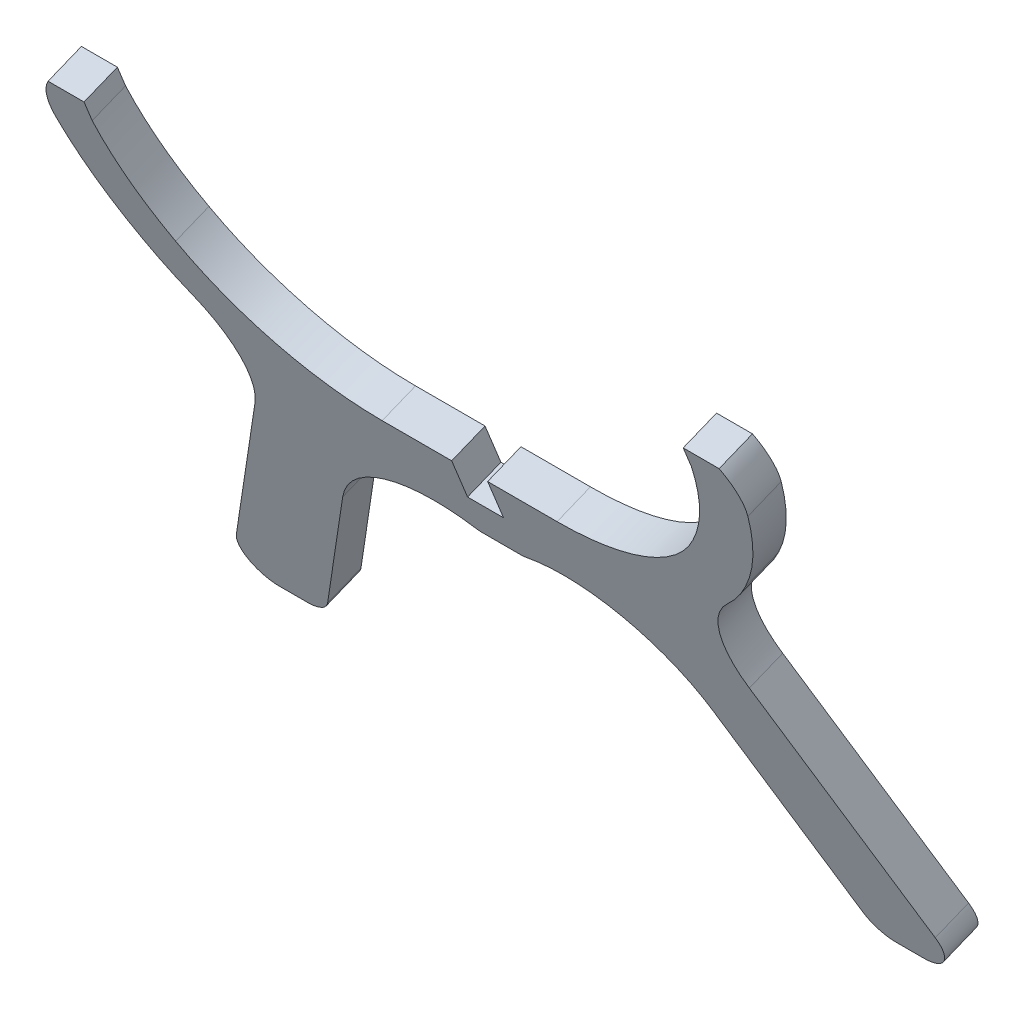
SolidWorks part; units mm, degrees
ref_plane "Спереди" through (0, 0, 0) normal (0, 0, 1) x (1, 0, 0)
ref_plane "Сверху" through (0, 0, 0) normal (0, 1, 0) x (1, 0, 0)
ref_plane "Справа" through (0, 0, 0) normal (1, 0, 0) x (0, 0, -1)
ref_plane "Плоскость4" through (0, 0, 0) normal (0, 0.3746, -0.9272) x (-1, 0, 0)
sketch "Эскиз1" plane through (0, 0, 0) normal (0, 0.3746, -0.9272) x (-1, 0, 0)
  line L0 (0, -535) -> (0, -802.9537) construction
  line L1 (-336, -220) -> (-300, -220) construction
  line L2 (300, -220) -> (719.5377, -220) construction
  line L3 (-452.8254, -802.9537) -> (523.246, -802.9537) construction
  line L4 (0, -535) -> (0, -45) construction
  line L5 (0, -510.8025) -> (0, -872.7774) construction
  line L6 (-300, -241.8808) -> (-300, -220)
  line L7 (-300, -220) -> (-336, -220)
  line L8 (-19.3609, -535) -> (19.3609, -535)
  line L9 (336, -220) -> (300, -220)
  line L10 (300, -220) -> (300, -241.8808)
  line L11 (87.5793, -450) -> (-87.5793, -450)
  line L12 (-300, -241.8808) -> (-300, -220)
  line L13 (-300, -220) -> (-336, -220)
  line L14 (-19.3609, -535) -> (19.3609, -535)
  line L15 (336, -220) -> (300, -220)
  line L16 (300, -220) -> (300, -241.8808)
  line L17 (87.5793, -450) -> (18, -450)
  line L19 (-155.527, -438.281) -> (-322.6744, -802.9537) construction
  line L20 (-247.5133, -536.9714) -> (-349.9462, -760.4537)
  line L21 (-185.4706, -605.6103) -> (-267.9017, -785.4537)
  line L22 (-193.8826, -419.963) -> (-361.3095, -785.2453) construction
  line L23 (-322.6744, -802.9537) -> (-295.1735, -802.9537)
  line L24 (-155.2475, -437.6713) -> (-322.6744, -802.9537) construction
  line L25 (247.5133, -536.9714) -> (349.9462, -760.4537)
  line L26 (-346.4425, -268.8974) -> (-346.4425, -845.878) construction
  line L27 (322.6744, -802.9537) -> (295.1735, -802.9537)
  line L28 (185.4706, -605.6103) -> (267.9017, -785.4537)
  line L29 (-116.6125, -455.3796) -> (-284.0394, -820.662) construction
  line L30 (-18, -450) -> (-18, -492.5)
  line L31 (-18, -492.5) -> (18, -492.5)
  line L32 (18, -450) -> (18, -492.5)
  line L33 (-18, -450) -> (-87.5793, -450)
  arc A0 (-267.9017, -785.4537) -> (-295.1735, -802.9537) centre (-295.1735, -772.9537) cw
  arc A1 (-349.9462, -760.4537) -> (-322.6744, -802.9537) centre (-322.6744, -772.9537) ccw
  arc A2 (-247.5133, -536.9714) -> (-267.3279, -424.9767) centre (-338.4192, -495.3047) ccw
  arc A5 (-25.2946, -534.0995) -> (-185.4706, -605.6103) centre (-64.7078, -660.9618) ccw
  arc A6 (301.1642, -382.4746) -> (267.3279, -424.9767) centre (87.5793, -247.158) cw
  arc A7 (247.5133, -536.9714) -> (267.3279, -424.9767) centre (338.4192, -495.3047) cw
  arc A8 (349.9462, -760.4537) -> (322.6744, -802.9537) centre (322.6744, -772.9537) cw
  arc A9 (25.2946, -534.0995) -> (19.3609, -535) centre (19.3609, -515) cw
  arc A10 (267.9017, -785.4537) -> (295.1735, -802.9537) centre (295.1735, -772.9537) ccw
  arc A11 (25.2946, -534.0995) -> (185.4706, -605.6103) centre (64.7078, -660.9618) cw
  arc A14 (-300, -241.8808) -> (-259.0513, -355.5196) centre (-35.9136, -210.9168) ccw
  arc A15 (-336, -220) -> (-346.4425, -268.8974) centre (-282.5771, -256.9727) ccw
  arc A16 (-346.4425, -268.8974) -> (-301.1642, -382.4746) centre (-35.9136, -210.9168) ccw
  arc A17 (-301.1642, -382.4746) -> (-87.5793, -500) centre (-87.5793, -247.158) ccw
  arc A18 (-35.6068, -526.6649) -> (-87.5793, -500) centre (-87.5793, -563.9822) ccw
  arc A19 (-35.6068, -526.6649) -> (-19.3609, -535) centre (-19.3609, -515) ccw
  arc A20 (19.3609, -535) -> (35.6068, -526.6649) centre (19.3609, -515) ccw
  arc A21 (87.5793, -500) -> (35.6068, -526.6649) centre (87.5793, -563.9822) ccw
  arc A22 (87.5793, -500) -> (301.1642, -382.4746) centre (87.5793, -247.158) ccw
  arc A23 (301.1642, -382.4746) -> (346.4425, -268.8974) centre (35.9136, -210.9168) ccw
  arc A24 (346.4425, -268.8974) -> (336, -220) centre (282.5771, -256.9727) ccw
  arc A25 (259.0513, -355.5196) -> (300, -241.8808) centre (35.9136, -210.9168) ccw
  arc A26 (87.5793, -450) -> (259.0513, -355.5196) centre (87.5793, -247.158) ccw
  arc A27 (-259.0513, -355.5196) -> (-87.5793, -450) centre (-87.5793, -247.158) ccw
  arc A28 (-300, -241.8808) -> (-259.0513, -355.5196) centre (-35.9136, -210.9168) ccw
  arc A29 (-336, -220) -> (-346.4425, -268.8974) centre (-282.5771, -256.9727) ccw
  arc A30 (-346.4425, -268.8974) -> (-301.1642, -382.4746) centre (-35.9136, -210.9168) ccw
  arc A31 (-301.1642, -382.4746) -> (-267.3279, -424.9767) centre (-87.5793, -247.158) ccw
  arc A33 (-25.2946, -534.0995) -> (-19.3609, -535) centre (-19.3609, -515) ccw
  arc A37 (301.1642, -382.4746) -> (346.4425, -268.8974) centre (35.9136, -210.9168) ccw
  arc A38 (346.4425, -268.8974) -> (336, -220) centre (282.5771, -256.9727) ccw
  arc A39 (259.0513, -355.5196) -> (300, -241.8808) centre (35.9136, -210.9168) ccw
  arc A40 (87.5793, -450) -> (259.0513, -355.5196) centre (87.5793, -247.158) ccw
  arc A41 (-259.0513, -355.5196) -> (-87.5793, -450) centre (-87.5793, -247.158) ccw
  point P19 (-167.4933, -478.627)
  point P20 (-282.0765, -824.915)
  point P22 (-320.5946, -806.9537)
  point P45 (-128.9752, -496.5883)
  point P65 (-274.7771, -802.9537)
  point P66 (-275.9228, -802.9537)
  point P68 (-346.4425, -758.5488)
  point P72 (0, -535)
  point P73 (-369.4261, -802.9537)
  point P89 (0, -492.5)
  dimension "D6" = 100
  dimension "D7" = 18
  dimension "D5" = 30
  dimension "D2" = 175
  dimension "D3" = 42.5
  dimension "D4" = 42.5
  dimension "D8" = 42.5
  dimension "D1" = 0
extrude "Бобышка-Вытянуть1" add sketch "Эскиз1" along normal mid plane 36
